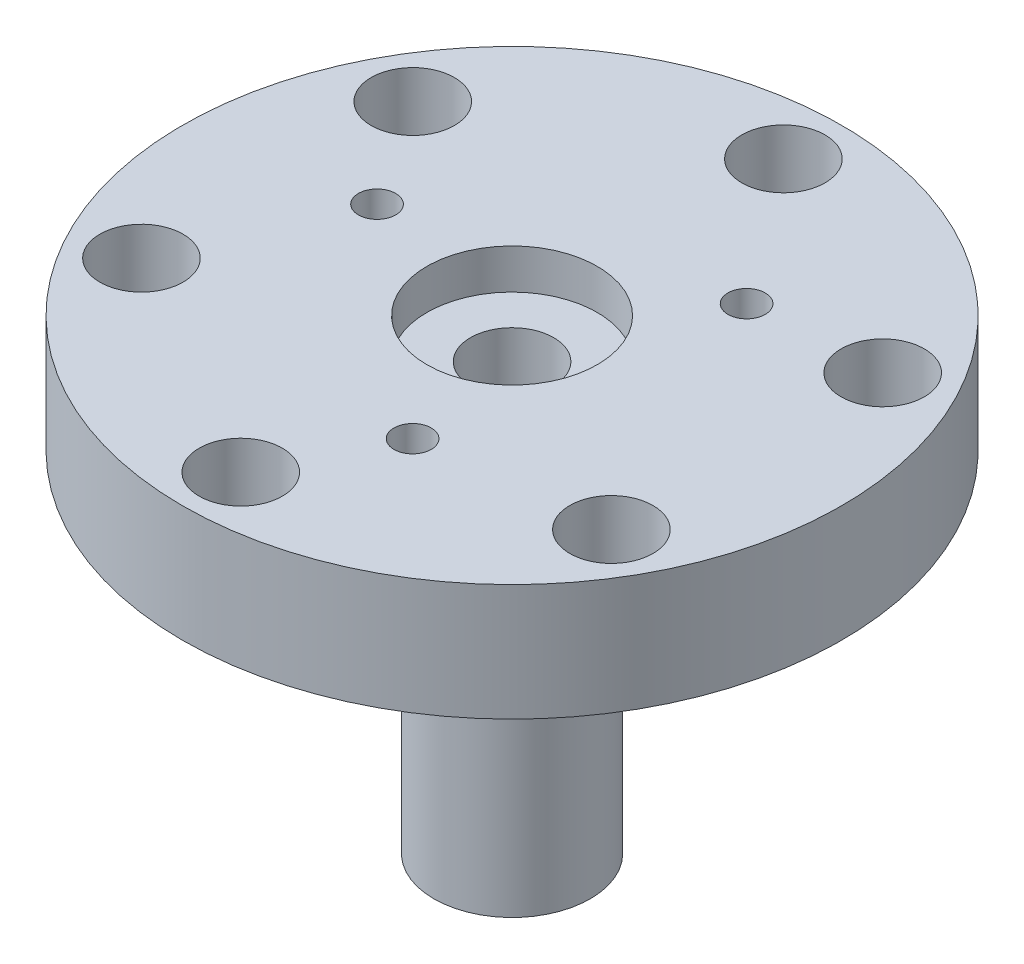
SolidWorks part; units mm, degrees
ref_plane "Front" through (0, 0, 0) normal (0, 0, 1) x (1, 0, 0)
ref_plane "Top" through (0, 0, 0) normal (0, 1, 0) x (1, 0, 0)
ref_plane "Right" through (0, 0, 0) normal (1, 0, 0) x (0, 0, -1)
sketch "Sketch1" plane through (0, 0, 0) normal (1, 0, 0) x (0, 0, -1)
  line L0 (0, 21.2253) -> (0, -53.1421) construction
  line L1 (-6.5024, 0) -> (-25.146, 0)
  line L2 (-25.146, 0) -> (-25.146, -8.89)
  line L3 (-25.146, -8.89) -> (-10.7188, -8.89)
  line L4 (-10.7188, -8.89) -> (-10.7188, -7.62)
  line L5 (-10.7188, -7.62) -> (-8.5852, -7.62)
  line L6 (-8.5852, -7.62) -> (-8.5852, -8.89)
  line L7 (-8.5852, -8.89) -> (-5.969, -8.89)
  line L8 (-5.969, -8.89) -> (-5.969, -35.56)
  line L9 (-5.969, -35.56) -> (-3.175, -35.56)
  line L10 (-3.175, -35.56) -> (-3.175, -26.67)
  line L11 (-3.175, -26.67) -> (-1.0287, -26.67)
  line L12 (-1.0287, -26.67) -> (-1.0287, -11.938)
  line L13 (-1.0287, -11.938) -> (-3.175, -11.938)
  line L14 (-3.175, -11.938) -> (-3.175, -3.048)
  line L15 (-3.175, -3.048) -> (-6.5024, -3.048)
  line L16 (-6.5024, -3.048) -> (-6.5024, 0)
  dimension "D1" = 2.0574
  dimension "D2" = 6.35
  dimension "D3" = 13.0048
  dimension "D4" = 11.938
  dimension "D5" = 17.1704
  dimension "D6" = 2.1336
  dimension "D7" = 8.89
  dimension "D8" = 1.27
  dimension "D9" = 3.048
  dimension "D10" = 8.89
  dimension "D11" = 8.89
  dimension "D12" = 50.292
  dimension "D13" = 35.56
revolve "Revolve1" add sketch "Sketch1" angle 360 about L0
sketch "Sketch2" plane through (0, 0, 0) normal (0, 1, 0) x (-1, 0, 0)
  line L0 (0, 0) -> (0, 24.2072) construction
  circle A0 centre (0, 0) radius 20.701 construction
  circle A1 centre (0, 20.701) radius 1.7272
  dimension "D1" = 41.402
  dimension "D2" = 3.4544
extrude "Cut-Extrude1" cut sketch "Sketch2" against normal through all
sketch "Sketch3" plane through (0, 0, 0) normal (0, 1, 0) x (-1, 0, 0)
  circle A0 centre (0, 20.701) radius 3.175
  circle A1 centre (0, 20.701) radius 1.7272 construction
  dimension "D1" = 6.35
extrude "Cut-Extrude2" cut sketch "Sketch3" against normal blind 5.842
pattern_circular "CirPattern1" count 6 over 360 about axis through (0, 0, 0) along (0, 1, 0) of "Cut-Extrude2", "Cut-Extrude1"
sketch "Sketch4" plane through (0, 0, 0) normal (0, 1, 0) x (-1, 0, 0)
  line L0 (0, 0) -> (-14.0965, -16.7995) construction
  line L1 (0, 0) -> (0, -29.493) construction
  circle A0 centre (0, 0) radius 12.7 construction
  circle A1 centre (-8.1634, -9.7288) radius 1.1303
  dimension "D1" = 25.4
  dimension "D3" = 2.2606
  dimension "D2" = 40
extrude "Cut-Extrude3" cut sketch "Sketch4" against normal blind 5.334
sketch "Sketch5" plane through (0, 0, 0) normal (0, 1, 0) x (-1, 0, 0)
  circle A0 centre (-8.1634, -9.7288) radius 1.4224
  dimension "D1" = 2.8448
extrude "Cut-Extrude4" cut sketch "Sketch5" against normal blind 4.064
pattern_circular "CirPattern2" count 3 over 360 about axis through (0, 0, 0) along (0, 1, 0) of "Cut-Extrude3", "Cut-Extrude4"
